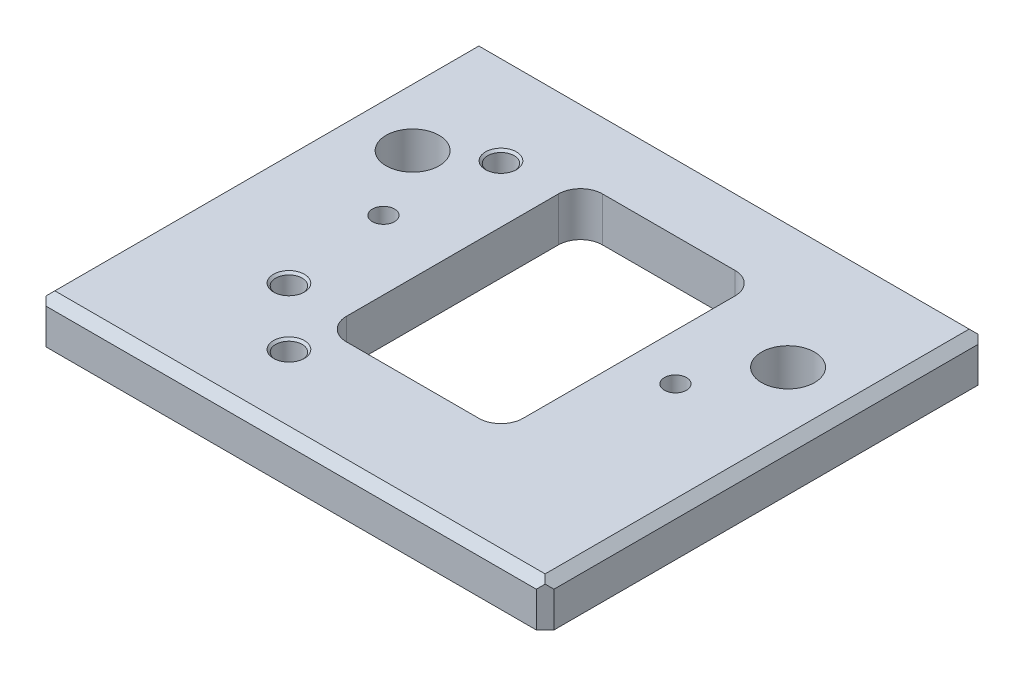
SolidWorks part; units mm, degrees
ref_plane "Plan de face" through (0, 0, 0) normal (0, 0, 1) x (1, 0, 0)
ref_plane "Plan de dessus" through (0, 0, 0) normal (0, 1, 0) x (1, 0, 0)
ref_plane "Plan de droite" through (0, 0, 0) normal (1, 0, 0) x (0, 0, -1)
sketch "Esquisse1" plane through (0, 0, 0) normal (0, 1, 0) x (1, 0, 0)
  line L1 (-30, -20) -> (85, -20)
  line L2 (-30, -20) -> (-30, 80)
  line L3 (-30, 80) -> (85, 80)
  line L4 (85, -20) -> (85, 80)
  line L5 (15, 5) -> (45, 5)
  line L6 (10, 10) -> (10, 58)
  line L7 (15, 63) -> (45, 63)
  line L8 (50, 10) -> (50, 58)
  arc A0 (45, 63) -> (50, 58) centre (45, 58) cw
  arc A1 (45, 5) -> (50, 10) centre (45, 10) ccw
  arc A2 (15, 5) -> (10, 10) centre (15, 10) cw
  arc A3 (10, 58) -> (15, 63) centre (15, 58) cw
  point P11 (50, 63)
  point P16 (10, 5)
  point P19 (10, 63)
  dimension "D9" = 5
  dimension "D1" = 115
  dimension "D2" = 100
  dimension "D3" = 30
  dimension "D4" = 20
  dimension "D5" = 40
  dimension "D6" = 58
  dimension "D7" = 5
  dimension "D8" = 10
extrude "Boss.-Extru.1" add sketch "Esquisse1" against normal blind 10
chamfer "Chanfrein1" distance 2 angle 45 4 edges at (85, -5, -80) (-30, -5, -80) (85, -5, 20) (-30, -5, 20)
chamfer "Chanfrein2" distance 2 angle 45 4 edges at (85, 0, -30) (27.5, 0, -80) (-30, 0, -30) (27.5, 0, 20)
sketch "Esquisse2" plane through (0, 0, 0) normal (0, 1, 0) x (1, 0, 0)
  line L1 (0, 0) -> (55, 0) construction
  line L2 (0, 0) -> (0, 68) construction
  line L3 (0, 68) -> (55, 68) construction
  line L4 (55, 0) -> (55, 68) construction
  dimension "D1" = 68
  dimension "D2" = 55
sketch "Esquisse3" plane through (0, 0, 0) normal (0, 1, 0) x (1, 0, 0)
  line L0 (0, 0) -> (0, 68) construction
  line L1 (0, 0) -> (55, 0) construction
  line L2 (0, 68) -> (55, 68) construction
  line L3 (-3, 58) -> (-3, 10) construction
  circle A0 centre (-3, 58) radius 3
  circle A1 centre (-3, 10) radius 3
  circle A2 centre (10, -3) radius 3
  point P13 (-3, 34)
  point P14 (-133.2304, 96.3523)
  point P15 (-37.8652, 117.5218)
  dimension "D1" = 6
  dimension "D2" = 10
  dimension "D3" = 10
  dimension "D4" = 10
extrude "Enlèv. mat.-Extru.1" cut sketch "Esquisse3" against normal through all
chamfer "Chanfrein3" distance 0.5 angle 45 6 edges at (10, -10, 6) (-3, -10, -7) (-3, -10, -55) (10, 0, 6) (-3, 0, -7) (-3, 0, -55)
ref_plane "Plan1" through (0, 0, -34) normal (0, 0, 1) x (1, 0, 0)
hole_wizard "Trou taraudé M61" positions "Esquisse6" profile "Esquisse5" tap size "M6" standard "Iso"
sketch "Esquisse6" plane through (0, 0, 0) normal (0, 1, 0) x (1, 0, 0)
  point P0 (-5.6, 34)
sketch "Esquisse5" plane through (-5.6, 0, -34) normal (1, 0, 0) x (0, 0, 1)
  line L0 (0, 0) -> (0, 10)
  line L1 (0, 10) -> (2.5, 10)
  line L2 (2.5, 10) -> (2.5, 0)
  line L5 (2.5, 0) -> (0, 0)
  line L11 (0, -6.35) -> (0, 107.95) construction
  dimension "Diamètre du trou pour taraudage jusqu'au prochain" = 5
  dimension "Profondeur du trou pour taraudage jusqu'au prochain" = 10
hole_wizard "Trou taraudé M64" positions "Esquisse14" profile "Esquisse13" tap size "M6" standard "Iso"
sketch "Esquisse14" plane through (0, 0, 0) normal (0, 1, 0) x (1, 0, 0)
  point P0 (60.5, 34)
sketch "Esquisse13" plane through (60.5, 0, -34) normal (1, 0, 0) x (0, 0, 1)
  line L0 (0, 0) -> (0, 18.5022)
  line L1 (0, 18.5022) -> (2.5, 17)
  line L2 (2.5, 17) -> (2.5, 0)
  line L5 (2.5, 0) -> (0, 0)
  line L10 (0, 18.5022) -> (-2.5, 17) construction
  line L11 (0, -6.35) -> (0, 107.95) construction
  dimension "Diamètre du trou pour taraudage" = 5
  dimension "Profondeur du trou pour taraudage" = 17
  dimension "Angle de pointe" = 118
sketch "Esquisse15" plane through (0, 0, 0) normal (0, 1, 0) x (1, 0, 0)
  line L0 (-30, -18) -> (-30, 78) construction
  line L1 (85, 78) -> (85, -18) construction
  line L2 (-28, 80) -> (83, 80) construction
  circle A0 centre (-15, 50) radius 6
  circle A1 centre (70, 50) radius 6
  dimension "D1" = 12
  dimension "D2" = 15
  dimension "D3" = 15
  dimension "D4" = 30
extrude "Enlèv. mat.-Extru.2" cut sketch "Esquisse15" against normal through all
